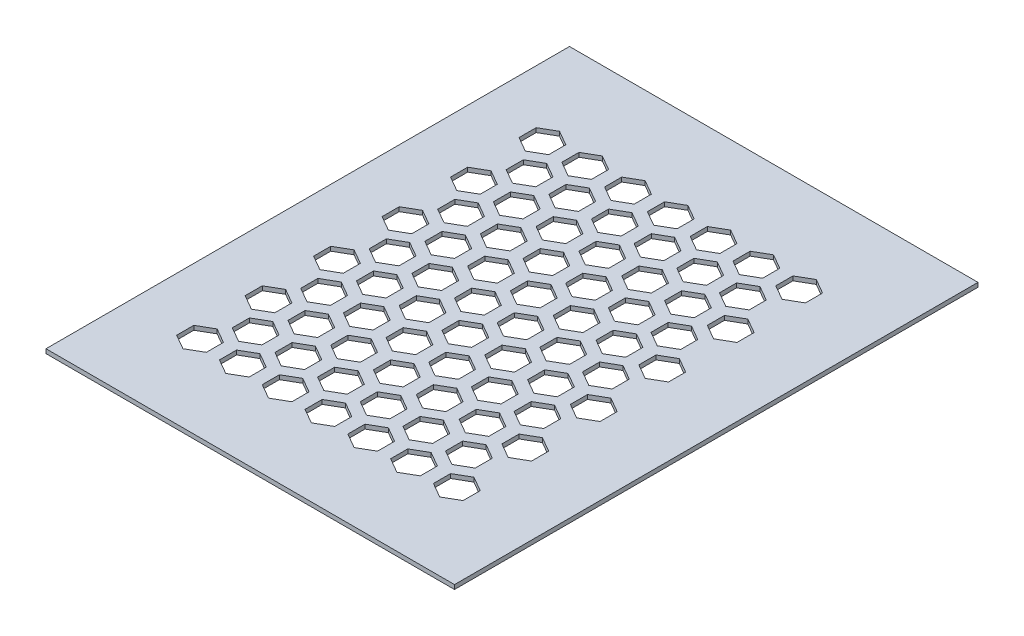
SolidWorks part; units mm, degrees
ref_plane "Front Plane" through (0, 0, 0) normal (0, 0, 1) x (1, 0, 0)
ref_plane "Top Plane" through (0, 0, 0) normal (0, 1, 0) x (1, 0, 0)
ref_plane "Right Plane" through (0, 0, 0) normal (1, 0, 0) x (0, 0, -1)
sketch "Sketch1" plane through (0, 402.2121, 0) normal (0, 1, 0) x (1, 0, 0)
  line L0 (-610.7154, -702.6158) -> (-607.5404, -702.6158) construction
  line L1 (-609.1279, -702.6158) -> (-912.2029, -702.6158)
  line L2 (-609.1279, -702.6158) -> (-609.1279, -1090.9892)
  line L3 (-609.1279, -1090.9892) -> (-912.2029, -1090.9892)
  line L4 (-912.2029, -702.6158) -> (-912.2029, -1090.9892)
extrude "Boss-Extrude1" add sketch "Sketch1" along normal blind 3.175
sketch "Sketch2" plane through (0, 405.3871, 0) normal (0, 1, 0) x (1, 0, 0)
  line L0 (-912.2029, -1090.9892) -> (-609.1279, -1090.9892) construction
  line L1 (-861.4156, -1014.7892) -> (-872.4141, -1021.1392)
  line L2 (-872.4141, -1021.1392) -> (-872.4141, -1033.8392)
  line L3 (-872.4141, -1033.8392) -> (-861.4156, -1040.1892)
  line L4 (-861.4156, -1040.1892) -> (-850.417, -1033.8392)
  line L5 (-850.417, -1033.8392) -> (-850.417, -1021.1392)
  line L6 (-850.417, -1021.1392) -> (-861.4156, -1014.7892)
  line L7 (-912.2029, -702.6158) -> (-912.2029, -1090.9892) construction
  line L8 (-829.6656, -1014.7892) -> (-840.6641, -1021.1392)
  line L9 (-840.6641, -1021.1392) -> (-840.6641, -1033.8392)
  line L10 (-840.6641, -1033.8392) -> (-829.6656, -1040.1892)
  line L11 (-829.6656, -1040.1892) -> (-818.667, -1033.8392)
  line L12 (-818.667, -1033.8392) -> (-818.667, -1021.1392)
  line L13 (-818.667, -1021.1392) -> (-829.6656, -1014.7892)
  line L14 (-797.9156, -1014.7892) -> (-808.9141, -1021.1392)
  line L15 (-808.9141, -1021.1392) -> (-808.9141, -1033.8392)
  line L16 (-808.9141, -1033.8392) -> (-797.9156, -1040.1892)
  line L17 (-797.9156, -1040.1892) -> (-786.917, -1033.8392)
  line L18 (-786.917, -1033.8392) -> (-786.917, -1021.1392)
  line L19 (-786.917, -1021.1392) -> (-797.9156, -1014.7892)
  line L20 (-766.1656, -1014.7892) -> (-777.1641, -1021.1392)
  line L21 (-777.1641, -1021.1392) -> (-777.1641, -1033.8392)
  line L22 (-777.1641, -1033.8392) -> (-766.1656, -1040.1892)
  line L23 (-766.1656, -1040.1892) -> (-755.167, -1033.8392)
  line L24 (-755.167, -1033.8392) -> (-755.167, -1021.1392)
  line L25 (-755.167, -1021.1392) -> (-766.1656, -1014.7892)
  line L26 (-734.4156, -1014.7892) -> (-745.4141, -1021.1392)
  line L27 (-745.4141, -1021.1392) -> (-745.4141, -1033.8392)
  line L28 (-745.4141, -1033.8392) -> (-734.4156, -1040.1892)
  line L29 (-734.4156, -1040.1892) -> (-723.417, -1033.8392)
  line L30 (-723.417, -1033.8392) -> (-723.417, -1021.1392)
  line L31 (-723.417, -1021.1392) -> (-734.4156, -1014.7892)
  line L32 (-702.6656, -1014.7892) -> (-713.6641, -1021.1392)
  line L33 (-713.6641, -1021.1392) -> (-713.6641, -1033.8392)
  line L34 (-713.6641, -1033.8392) -> (-702.6656, -1040.1892)
  line L35 (-702.6656, -1040.1892) -> (-691.667, -1033.8392)
  line L36 (-691.667, -1033.8392) -> (-691.667, -1021.1392)
  line L37 (-691.667, -1021.1392) -> (-702.6656, -1014.7892)
  line L38 (-670.9156, -1014.7892) -> (-681.9141, -1021.1392)
  line L39 (-681.9141, -1021.1392) -> (-681.9141, -1033.8392)
  line L40 (-681.9141, -1033.8392) -> (-670.9156, -1040.1892)
  line L41 (-670.9156, -1040.1892) -> (-659.917, -1033.8392)
  line L42 (-659.917, -1033.8392) -> (-659.917, -1021.1392)
  line L43 (-659.917, -1021.1392) -> (-670.9156, -1014.7892)
  line L44 (-850.417, -1021.1392) -> (-840.6641, -1021.1392) construction
  line L45 (-834.542, -1008.4392) -> (-834.542, -995.7392)
  line L46 (-834.542, -995.7392) -> (-845.5406, -989.3892)
  line L47 (-845.5406, -989.3892) -> (-856.5391, -995.7392)
  line L48 (-856.5391, -995.7392) -> (-856.5391, -1008.4392)
  line L49 (-856.5391, -1008.4392) -> (-845.5406, -1014.7892)
  line L50 (-845.5406, -1014.7892) -> (-834.542, -1008.4392)
  line L51 (-802.8936, -1008.4392) -> (-802.8936, -995.7392)
  line L52 (-802.8936, -995.7392) -> (-813.8922, -989.3892)
  line L53 (-813.8922, -989.3892) -> (-824.8907, -995.7392)
  line L54 (-824.8907, -995.7392) -> (-824.8907, -1008.4392)
  line L55 (-824.8907, -1008.4392) -> (-813.8922, -1014.7892)
  line L56 (-813.8922, -1014.7892) -> (-802.8936, -1008.4392)
  line L57 (-771.2452, -1008.4392) -> (-771.2452, -995.7392)
  line L58 (-771.2452, -995.7392) -> (-782.2438, -989.3892)
  line L59 (-782.2438, -989.3892) -> (-793.2423, -995.7392)
  line L60 (-793.2423, -995.7392) -> (-793.2423, -1008.4392)
  line L61 (-793.2423, -1008.4392) -> (-782.2438, -1014.7892)
  line L62 (-782.2438, -1014.7892) -> (-771.2452, -1008.4392)
  line L63 (-739.5968, -1008.4392) -> (-739.5968, -995.7392)
  line L64 (-739.5968, -995.7392) -> (-750.5954, -989.3892)
  line L65 (-750.5954, -989.3892) -> (-761.5939, -995.7392)
  line L66 (-761.5939, -995.7392) -> (-761.5939, -1008.4392)
  line L67 (-761.5939, -1008.4392) -> (-750.5954, -1014.7892)
  line L68 (-750.5954, -1014.7892) -> (-739.5968, -1008.4392)
  line L69 (-707.9484, -1008.4392) -> (-707.9484, -995.7392)
  line L70 (-707.9484, -995.7392) -> (-718.947, -989.3892)
  line L71 (-718.947, -989.3892) -> (-729.9455, -995.7392)
  line L72 (-729.9455, -995.7392) -> (-729.9455, -1008.4392)
  line L73 (-729.9455, -1008.4392) -> (-718.947, -1014.7892)
  line L74 (-718.947, -1014.7892) -> (-707.9484, -1008.4392)
  line L75 (-676.3, -1008.4392) -> (-676.3, -995.7392)
  line L76 (-676.3, -995.7392) -> (-687.2986, -989.3892)
  line L77 (-687.2986, -989.3892) -> (-698.2971, -995.7392)
  line L78 (-698.2971, -995.7392) -> (-698.2971, -1008.4392)
  line L79 (-698.2971, -1008.4392) -> (-687.2986, -1014.7892)
  line L80 (-687.2986, -1014.7892) -> (-676.3, -1008.4392)
  line L81 (-670.9156, -963.9892) -> (-681.9141, -970.3392)
  line L82 (-681.9141, -970.3392) -> (-681.9141, -983.0392)
  line L83 (-681.9141, -983.0392) -> (-670.9156, -989.3892)
  line L84 (-670.9156, -989.3892) -> (-659.917, -983.0392)
  line L85 (-659.917, -983.0392) -> (-659.917, -970.3392)
  line L86 (-659.917, -970.3392) -> (-670.9156, -963.9892)
  line L87 (-702.6656, -963.9892) -> (-713.6641, -970.3392)
  line L88 (-713.6641, -970.3392) -> (-713.6641, -983.0392)
  line L89 (-713.6641, -983.0392) -> (-702.6656, -989.3892)
  line L90 (-702.6656, -989.3892) -> (-691.667, -983.0392)
  line L91 (-691.667, -983.0392) -> (-691.667, -970.3392)
  line L92 (-691.667, -970.3392) -> (-702.6656, -963.9892)
  line L93 (-734.4156, -963.9892) -> (-745.4141, -970.3392)
  line L94 (-745.4141, -970.3392) -> (-745.4141, -983.0392)
  line L95 (-745.4141, -983.0392) -> (-734.4156, -989.3892)
  line L96 (-734.4156, -989.3892) -> (-723.417, -983.0392)
  line L97 (-723.417, -983.0392) -> (-723.417, -970.3392)
  line L98 (-723.417, -970.3392) -> (-734.4156, -963.9892)
  line L99 (-766.1656, -963.9892) -> (-777.1641, -970.3392)
  line L100 (-777.1641, -970.3392) -> (-777.1641, -983.0392)
  line L101 (-777.1641, -983.0392) -> (-766.1656, -989.3892)
  line L102 (-766.1656, -989.3892) -> (-755.167, -983.0392)
  line L103 (-755.167, -983.0392) -> (-755.167, -970.3392)
  line L104 (-755.167, -970.3392) -> (-766.1656, -963.9892)
  line L105 (-797.9156, -963.9892) -> (-808.9141, -970.3392)
  line L106 (-808.9141, -970.3392) -> (-808.9141, -983.0392)
  line L107 (-808.9141, -983.0392) -> (-797.9156, -989.3892)
  line L108 (-797.9156, -989.3892) -> (-786.917, -983.0392)
  line L109 (-786.917, -983.0392) -> (-786.917, -970.3392)
  line L110 (-786.917, -970.3392) -> (-797.9156, -963.9892)
  line L111 (-829.6656, -963.9892) -> (-840.6641, -970.3392)
  line L112 (-840.6641, -970.3392) -> (-840.6641, -983.0392)
  line L113 (-840.6641, -983.0392) -> (-829.6656, -989.3892)
  line L114 (-829.6656, -989.3892) -> (-818.667, -983.0392)
  line L115 (-818.667, -983.0392) -> (-818.667, -970.3392)
  line L116 (-818.667, -970.3392) -> (-829.6656, -963.9892)
  line L117 (-861.4156, -963.9892) -> (-872.4141, -970.3392)
  line L118 (-872.4141, -970.3392) -> (-872.4141, -983.0392)
  line L119 (-872.4141, -983.0392) -> (-861.4156, -989.3892)
  line L120 (-861.4156, -989.3892) -> (-850.417, -983.0392)
  line L121 (-850.417, -983.0392) -> (-850.417, -970.3392)
  line L122 (-850.417, -970.3392) -> (-861.4156, -963.9892)
  line L123 (-834.542, -957.6392) -> (-834.542, -944.9392)
  line L124 (-834.542, -944.9392) -> (-845.5406, -938.5892)
  line L125 (-845.5406, -938.5892) -> (-856.5391, -944.9392)
  line L126 (-856.5391, -944.9392) -> (-856.5391, -957.6392)
  line L127 (-856.5391, -957.6392) -> (-845.5406, -963.9892)
  line L128 (-845.5406, -963.9892) -> (-834.542, -957.6392)
  line L129 (-802.8936, -957.6392) -> (-802.8936, -944.9392)
  line L130 (-802.8936, -944.9392) -> (-813.8922, -938.5892)
  line L131 (-813.8922, -938.5892) -> (-824.8907, -944.9392)
  line L132 (-824.8907, -944.9392) -> (-824.8907, -957.6392)
  line L133 (-824.8907, -957.6392) -> (-813.8922, -963.9892)
  line L134 (-813.8922, -963.9892) -> (-802.8936, -957.6392)
  line L135 (-771.2452, -957.6392) -> (-771.2452, -944.9392)
  line L136 (-771.2452, -944.9392) -> (-782.2438, -938.5892)
  line L137 (-782.2438, -938.5892) -> (-793.2423, -944.9392)
  line L138 (-793.2423, -944.9392) -> (-793.2423, -957.6392)
  line L139 (-793.2423, -957.6392) -> (-782.2438, -963.9892)
  line L140 (-782.2438, -963.9892) -> (-771.2452, -957.6392)
  line L141 (-739.5968, -957.6392) -> (-739.5968, -944.9392)
  line L142 (-739.5968, -944.9392) -> (-750.5954, -938.5892)
  line L143 (-750.5954, -938.5892) -> (-761.5939, -944.9392)
  line L144 (-761.5939, -944.9392) -> (-761.5939, -957.6392)
  line L145 (-761.5939, -957.6392) -> (-750.5954, -963.9892)
  line L146 (-750.5954, -963.9892) -> (-739.5968, -957.6392)
  line L147 (-707.9484, -957.6392) -> (-707.9484, -944.9392)
  line L148 (-707.9484, -944.9392) -> (-718.947, -938.5892)
  line L149 (-718.947, -938.5892) -> (-729.9455, -944.9392)
  line L150 (-729.9455, -944.9392) -> (-729.9455, -957.6392)
  line L151 (-729.9455, -957.6392) -> (-718.947, -963.9892)
  line L152 (-718.947, -963.9892) -> (-707.9484, -957.6392)
  line L153 (-676.3, -957.6392) -> (-676.3, -944.9392)
  line L154 (-676.3, -944.9392) -> (-687.2986, -938.5892)
  line L155 (-687.2986, -938.5892) -> (-698.2971, -944.9392)
  line L156 (-698.2971, -944.9392) -> (-698.2971, -957.6392)
  line L157 (-698.2971, -957.6392) -> (-687.2986, -963.9892)
  line L158 (-687.2986, -963.9892) -> (-676.3, -957.6392)
  line L159 (-670.9156, -913.1892) -> (-681.9141, -919.5392)
  line L160 (-681.9141, -919.5392) -> (-681.9141, -932.2392)
  line L161 (-681.9141, -932.2392) -> (-670.9156, -938.5892)
  line L162 (-670.9156, -938.5892) -> (-659.917, -932.2392)
  line L163 (-659.917, -932.2392) -> (-659.917, -919.5392)
  line L164 (-659.917, -919.5392) -> (-670.9156, -913.1892)
  line L165 (-702.6656, -913.1892) -> (-713.6641, -919.5392)
  line L166 (-713.6641, -919.5392) -> (-713.6641, -932.2392)
  line L167 (-713.6641, -932.2392) -> (-702.6656, -938.5892)
  line L168 (-702.6656, -938.5892) -> (-691.667, -932.2392)
  line L169 (-691.667, -932.2392) -> (-691.667, -919.5392)
  line L170 (-691.667, -919.5392) -> (-702.6656, -913.1892)
  line L171 (-734.4156, -913.1892) -> (-745.4141, -919.5392)
  line L172 (-745.4141, -919.5392) -> (-745.4141, -932.2392)
  line L173 (-745.4141, -932.2392) -> (-734.4156, -938.5892)
  line L174 (-734.4156, -938.5892) -> (-723.417, -932.2392)
  line L175 (-723.417, -932.2392) -> (-723.417, -919.5392)
  line L176 (-723.417, -919.5392) -> (-734.4156, -913.1892)
  line L177 (-766.1656, -913.1892) -> (-777.1641, -919.5392)
  line L178 (-777.1641, -919.5392) -> (-777.1641, -932.2392)
  line L179 (-777.1641, -932.2392) -> (-766.1656, -938.5892)
  line L180 (-766.1656, -938.5892) -> (-755.167, -932.2392)
  line L181 (-755.167, -932.2392) -> (-755.167, -919.5392)
  line L182 (-755.167, -919.5392) -> (-766.1656, -913.1892)
  line L183 (-797.9156, -913.1892) -> (-808.9141, -919.5392)
  line L184 (-808.9141, -919.5392) -> (-808.9141, -932.2392)
  line L185 (-808.9141, -932.2392) -> (-797.9156, -938.5892)
  line L186 (-797.9156, -938.5892) -> (-786.917, -932.2392)
  line L187 (-786.917, -932.2392) -> (-786.917, -919.5392)
  line L188 (-786.917, -919.5392) -> (-797.9156, -913.1892)
  line L189 (-829.6656, -913.1892) -> (-840.6641, -919.5392)
  line L190 (-840.6641, -919.5392) -> (-840.6641, -932.2392)
  line L191 (-840.6641, -932.2392) -> (-829.6656, -938.5892)
  line L192 (-829.6656, -938.5892) -> (-818.667, -932.2392)
  line L193 (-818.667, -932.2392) -> (-818.667, -919.5392)
  line L194 (-818.667, -919.5392) -> (-829.6656, -913.1892)
  line L195 (-861.4156, -913.1892) -> (-872.4141, -919.5392)
  line L196 (-872.4141, -919.5392) -> (-872.4141, -932.2392)
  line L197 (-872.4141, -932.2392) -> (-861.4156, -938.5892)
  line L198 (-861.4156, -938.5892) -> (-850.417, -932.2392)
  line L199 (-850.417, -932.2392) -> (-850.417, -919.5392)
  line L200 (-850.417, -919.5392) -> (-861.4156, -913.1892)
  line L201 (-834.542, -906.8392) -> (-834.542, -894.1392)
  line L202 (-834.542, -894.1392) -> (-845.5406, -887.7892)
  line L203 (-845.5406, -887.7892) -> (-856.5391, -894.1392)
  line L204 (-856.5391, -894.1392) -> (-856.5391, -906.8392)
  line L205 (-856.5391, -906.8392) -> (-845.5406, -913.1892)
  line L206 (-845.5406, -913.1892) -> (-834.542, -906.8392)
  line L207 (-802.8936, -906.8392) -> (-802.8936, -894.1392)
  line L208 (-802.8936, -894.1392) -> (-813.8922, -887.7892)
  line L209 (-813.8922, -887.7892) -> (-824.8907, -894.1392)
  line L210 (-824.8907, -894.1392) -> (-824.8907, -906.8392)
  line L211 (-824.8907, -906.8392) -> (-813.8922, -913.1892)
  line L212 (-813.8922, -913.1892) -> (-802.8936, -906.8392)
  line L213 (-771.2452, -906.8392) -> (-771.2452, -894.1392)
  line L214 (-771.2452, -894.1392) -> (-782.2438, -887.7892)
  line L215 (-782.2438, -887.7892) -> (-793.2423, -894.1392)
  line L216 (-793.2423, -894.1392) -> (-793.2423, -906.8392)
  line L217 (-793.2423, -906.8392) -> (-782.2438, -913.1892)
  line L218 (-782.2438, -913.1892) -> (-771.2452, -906.8392)
  line L219 (-739.5968, -906.8392) -> (-739.5968, -894.1392)
  line L220 (-739.5968, -894.1392) -> (-750.5954, -887.7892)
  line L221 (-750.5954, -887.7892) -> (-761.5939, -894.1392)
  line L222 (-761.5939, -894.1392) -> (-761.5939, -906.8392)
  line L223 (-761.5939, -906.8392) -> (-750.5954, -913.1892)
  line L224 (-750.5954, -913.1892) -> (-739.5968, -906.8392)
  line L225 (-707.9484, -906.8392) -> (-707.9484, -894.1392)
  line L226 (-707.9484, -894.1392) -> (-718.947, -887.7892)
  line L227 (-718.947, -887.7892) -> (-729.9455, -894.1392)
  line L228 (-729.9455, -894.1392) -> (-729.9455, -906.8392)
  line L229 (-729.9455, -906.8392) -> (-718.947, -913.1892)
  line L230 (-718.947, -913.1892) -> (-707.9484, -906.8392)
  line L231 (-676.3, -906.8392) -> (-676.3, -894.1392)
  line L232 (-676.3, -894.1392) -> (-687.2986, -887.7892)
  line L233 (-687.2986, -887.7892) -> (-698.2971, -894.1392)
  line L234 (-698.2971, -894.1392) -> (-698.2971, -906.8392)
  line L235 (-698.2971, -906.8392) -> (-687.2986, -913.1892)
  line L236 (-687.2986, -913.1892) -> (-676.3, -906.8392)
  line L237 (-670.9156, -862.3892) -> (-681.9141, -868.7392)
  line L238 (-681.9141, -868.7392) -> (-681.9141, -881.4392)
  line L239 (-681.9141, -881.4392) -> (-670.9156, -887.7892)
  line L240 (-670.9156, -887.7892) -> (-659.917, -881.4392)
  line L241 (-659.917, -881.4392) -> (-659.917, -868.7392)
  line L242 (-659.917, -868.7392) -> (-670.9156, -862.3892)
  line L243 (-702.6656, -862.3892) -> (-713.6641, -868.7392)
  line L244 (-713.6641, -868.7392) -> (-713.6641, -881.4392)
  line L245 (-713.6641, -881.4392) -> (-702.6656, -887.7892)
  line L246 (-702.6656, -887.7892) -> (-691.667, -881.4392)
  line L247 (-691.667, -881.4392) -> (-691.667, -868.7392)
  line L248 (-691.667, -868.7392) -> (-702.6656, -862.3892)
  line L249 (-734.4156, -862.3892) -> (-745.4141, -868.7392)
  line L250 (-745.4141, -868.7392) -> (-745.4141, -881.4392)
  line L251 (-745.4141, -881.4392) -> (-734.4156, -887.7892)
  line L252 (-734.4156, -887.7892) -> (-723.417, -881.4392)
  line L253 (-723.417, -881.4392) -> (-723.417, -868.7392)
  line L254 (-723.417, -868.7392) -> (-734.4156, -862.3892)
  line L255 (-766.1656, -862.3892) -> (-777.1641, -868.7392)
  line L256 (-777.1641, -868.7392) -> (-777.1641, -881.4392)
  line L257 (-777.1641, -881.4392) -> (-766.1656, -887.7892)
  line L258 (-766.1656, -887.7892) -> (-755.167, -881.4392)
  line L259 (-755.167, -881.4392) -> (-755.167, -868.7392)
  line L260 (-755.167, -868.7392) -> (-766.1656, -862.3892)
  line L261 (-797.9156, -862.3892) -> (-808.9141, -868.7392)
  line L262 (-808.9141, -868.7392) -> (-808.9141, -881.4392)
  line L263 (-808.9141, -881.4392) -> (-797.9156, -887.7892)
  line L264 (-797.9156, -887.7892) -> (-786.917, -881.4392)
  line L265 (-786.917, -881.4392) -> (-786.917, -868.7392)
  line L266 (-786.917, -868.7392) -> (-797.9156, -862.3892)
  line L267 (-829.6656, -862.3892) -> (-840.6641, -868.7392)
  line L268 (-840.6641, -868.7392) -> (-840.6641, -881.4392)
  line L269 (-840.6641, -881.4392) -> (-829.6656, -887.7892)
  line L270 (-829.6656, -887.7892) -> (-818.667, -881.4392)
  line L271 (-818.667, -881.4392) -> (-818.667, -868.7392)
  line L272 (-818.667, -868.7392) -> (-829.6656, -862.3892)
  line L273 (-861.4156, -862.3892) -> (-872.4141, -868.7392)
  line L274 (-872.4141, -868.7392) -> (-872.4141, -881.4392)
  line L275 (-872.4141, -881.4392) -> (-861.4156, -887.7892)
  line L276 (-861.4156, -887.7892) -> (-850.417, -881.4392)
  line L277 (-850.417, -881.4392) -> (-850.417, -868.7392)
  line L278 (-850.417, -868.7392) -> (-861.4156, -862.3892)
  line L279 (-834.542, -856.0392) -> (-834.542, -843.3392)
  line L280 (-834.542, -843.3392) -> (-845.5406, -836.9892)
  line L281 (-845.5406, -836.9892) -> (-856.5391, -843.3392)
  line L282 (-856.5391, -843.3392) -> (-856.5391, -856.0392)
  line L283 (-856.5391, -856.0392) -> (-845.5406, -862.3892)
  line L284 (-845.5406, -862.3892) -> (-834.542, -856.0392)
  line L285 (-802.8936, -856.0392) -> (-802.8936, -843.3392)
  line L286 (-802.8936, -843.3392) -> (-813.8922, -836.9892)
  line L287 (-813.8922, -836.9892) -> (-824.8907, -843.3392)
  line L288 (-824.8907, -843.3392) -> (-824.8907, -856.0392)
  line L289 (-824.8907, -856.0392) -> (-813.8922, -862.3892)
  line L290 (-813.8922, -862.3892) -> (-802.8936, -856.0392)
  line L291 (-771.2452, -856.0392) -> (-771.2452, -843.3392)
  line L292 (-771.2452, -843.3392) -> (-782.2438, -836.9892)
  line L293 (-782.2438, -836.9892) -> (-793.2423, -843.3392)
  line L294 (-793.2423, -843.3392) -> (-793.2423, -856.0392)
  line L295 (-793.2423, -856.0392) -> (-782.2438, -862.3892)
  line L296 (-782.2438, -862.3892) -> (-771.2452, -856.0392)
  line L297 (-739.5968, -856.0392) -> (-739.5968, -843.3392)
  line L298 (-739.5968, -843.3392) -> (-750.5954, -836.9892)
  line L299 (-750.5954, -836.9892) -> (-761.5939, -843.3392)
  line L300 (-761.5939, -843.3392) -> (-761.5939, -856.0392)
  line L301 (-761.5939, -856.0392) -> (-750.5954, -862.3892)
  line L302 (-750.5954, -862.3892) -> (-739.5968, -856.0392)
  line L303 (-707.9484, -856.0392) -> (-707.9484, -843.3392)
  line L304 (-707.9484, -843.3392) -> (-718.947, -836.9892)
  line L305 (-718.947, -836.9892) -> (-729.9455, -843.3392)
  line L306 (-729.9455, -843.3392) -> (-729.9455, -856.0392)
  line L307 (-729.9455, -856.0392) -> (-718.947, -862.3892)
  line L308 (-718.947, -862.3892) -> (-707.9484, -856.0392)
  line L309 (-676.3, -856.0392) -> (-676.3, -843.3392)
  line L310 (-676.3, -843.3392) -> (-687.2986, -836.9892)
  line L311 (-687.2986, -836.9892) -> (-698.2971, -843.3392)
  line L312 (-698.2971, -843.3392) -> (-698.2971, -856.0392)
  line L313 (-698.2971, -856.0392) -> (-687.2986, -862.3892)
  line L314 (-687.2986, -862.3892) -> (-676.3, -856.0392)
  line L315 (-670.9156, -811.5892) -> (-681.9141, -817.9392)
  line L316 (-681.9141, -817.9392) -> (-681.9141, -830.6392)
  line L317 (-681.9141, -830.6392) -> (-670.9156, -836.9892)
  line L318 (-670.9156, -836.9892) -> (-659.917, -830.6392)
  line L319 (-659.917, -830.6392) -> (-659.917, -817.9392)
  line L320 (-659.917, -817.9392) -> (-670.9156, -811.5892)
  line L321 (-702.6656, -811.5892) -> (-713.6641, -817.9392)
  line L322 (-713.6641, -817.9392) -> (-713.6641, -830.6392)
  line L323 (-713.6641, -830.6392) -> (-702.6656, -836.9892)
  line L324 (-702.6656, -836.9892) -> (-691.667, -830.6392)
  line L325 (-691.667, -830.6392) -> (-691.667, -817.9392)
  line L326 (-691.667, -817.9392) -> (-702.6656, -811.5892)
  line L327 (-734.4156, -811.5892) -> (-745.4141, -817.9392)
  line L328 (-745.4141, -817.9392) -> (-745.4141, -830.6392)
  line L329 (-745.4141, -830.6392) -> (-734.4156, -836.9892)
  line L330 (-734.4156, -836.9892) -> (-723.417, -830.6392)
  line L331 (-723.417, -830.6392) -> (-723.417, -817.9392)
  line L332 (-723.417, -817.9392) -> (-734.4156, -811.5892)
  line L333 (-766.1656, -811.5892) -> (-777.1641, -817.9392)
  line L334 (-777.1641, -817.9392) -> (-777.1641, -830.6392)
  line L335 (-777.1641, -830.6392) -> (-766.1656, -836.9892)
  line L336 (-766.1656, -836.9892) -> (-755.167, -830.6392)
  line L337 (-755.167, -830.6392) -> (-755.167, -817.9392)
  line L338 (-755.167, -817.9392) -> (-766.1656, -811.5892)
  line L339 (-797.9156, -811.5892) -> (-808.9141, -817.9392)
  line L340 (-808.9141, -817.9392) -> (-808.9141, -830.6392)
  line L341 (-808.9141, -830.6392) -> (-797.9156, -836.9892)
  line L342 (-797.9156, -836.9892) -> (-786.917, -830.6392)
  line L343 (-786.917, -830.6392) -> (-786.917, -817.9392)
  line L344 (-786.917, -817.9392) -> (-797.9156, -811.5892)
  line L345 (-829.6656, -811.5892) -> (-840.6641, -817.9392)
  line L346 (-840.6641, -817.9392) -> (-840.6641, -830.6392)
  line L347 (-840.6641, -830.6392) -> (-829.6656, -836.9892)
  line L348 (-829.6656, -836.9892) -> (-818.667, -830.6392)
  line L349 (-818.667, -830.6392) -> (-818.667, -817.9392)
  line L350 (-818.667, -817.9392) -> (-829.6656, -811.5892)
  line L351 (-861.4156, -811.5892) -> (-872.4141, -817.9392)
  line L352 (-872.4141, -817.9392) -> (-872.4141, -830.6392)
  line L353 (-872.4141, -830.6392) -> (-861.4156, -836.9892)
  line L354 (-861.4156, -836.9892) -> (-850.417, -830.6392)
  line L355 (-850.417, -830.6392) -> (-850.417, -817.9392)
  line L356 (-850.417, -817.9392) -> (-861.4156, -811.5892)
  line L357 (-834.542, -805.2392) -> (-834.542, -792.5392)
  line L358 (-834.542, -792.5392) -> (-845.5406, -786.1892)
  line L359 (-845.5406, -786.1892) -> (-856.5391, -792.5392)
  line L360 (-856.5391, -792.5392) -> (-856.5391, -805.2392)
  line L361 (-856.5391, -805.2392) -> (-845.5406, -811.5892)
  line L362 (-845.5406, -811.5892) -> (-834.542, -805.2392)
  line L363 (-802.8936, -805.2392) -> (-802.8936, -792.5392)
  line L364 (-802.8936, -792.5392) -> (-813.8922, -786.1892)
  line L365 (-813.8922, -786.1892) -> (-824.8907, -792.5392)
  line L366 (-824.8907, -792.5392) -> (-824.8907, -805.2392)
  line L367 (-824.8907, -805.2392) -> (-813.8922, -811.5892)
  line L368 (-813.8922, -811.5892) -> (-802.8936, -805.2392)
  line L369 (-771.2452, -805.2392) -> (-771.2452, -792.5392)
  line L370 (-771.2452, -792.5392) -> (-782.2438, -786.1892)
  line L371 (-782.2438, -786.1892) -> (-793.2423, -792.5392)
  line L372 (-793.2423, -792.5392) -> (-793.2423, -805.2392)
  line L373 (-793.2423, -805.2392) -> (-782.2438, -811.5892)
  line L374 (-782.2438, -811.5892) -> (-771.2452, -805.2392)
  line L375 (-739.5968, -805.2392) -> (-739.5968, -792.5392)
  line L376 (-739.5968, -792.5392) -> (-750.5954, -786.1892)
  line L377 (-750.5954, -786.1892) -> (-761.5939, -792.5392)
  line L378 (-761.5939, -792.5392) -> (-761.5939, -805.2392)
  line L379 (-761.5939, -805.2392) -> (-750.5954, -811.5892)
  line L380 (-750.5954, -811.5892) -> (-739.5968, -805.2392)
  line L381 (-707.9484, -805.2392) -> (-707.9484, -792.5392)
  line L382 (-707.9484, -792.5392) -> (-718.947, -786.1892)
  line L383 (-718.947, -786.1892) -> (-729.9455, -792.5392)
  line L384 (-729.9455, -792.5392) -> (-729.9455, -805.2392)
  line L385 (-729.9455, -805.2392) -> (-718.947, -811.5892)
  line L386 (-718.947, -811.5892) -> (-707.9484, -805.2392)
  line L387 (-676.3, -805.2392) -> (-676.3, -792.5392)
  line L388 (-676.3, -792.5392) -> (-687.2986, -786.1892)
  line L389 (-687.2986, -786.1892) -> (-698.2971, -792.5392)
  line L390 (-698.2971, -792.5392) -> (-698.2971, -805.2392)
  line L391 (-698.2971, -805.2392) -> (-687.2986, -811.5892)
  line L392 (-687.2986, -811.5892) -> (-676.3, -805.2392)
  line L394 (-872.4141, -767.1392) -> (-872.4141, -779.8392)
  line L395 (-872.4141, -779.8392) -> (-861.4156, -786.1892)
  line L396 (-861.4156, -786.1892) -> (-850.417, -779.8392)
  line L397 (-850.417, -779.8392) -> (-850.417, -767.1392)
  line L398 (-850.417, -767.1392) -> (-861.4156, -760.7892)
  line L399 (-861.4156, -760.7892) -> (-872.4141, -767.1392)
  line L400 (-840.6641, -767.1392) -> (-840.6641, -779.8392)
  line L401 (-840.6641, -779.8392) -> (-829.6656, -786.1892)
  line L402 (-829.6656, -786.1892) -> (-818.667, -779.8392)
  line L403 (-818.667, -779.8392) -> (-818.667, -767.1392)
  line L404 (-818.667, -767.1392) -> (-829.6656, -760.7892)
  line L405 (-829.6656, -760.7892) -> (-840.6641, -767.1392)
  line L406 (-808.9141, -767.1392) -> (-808.9141, -779.8392)
  line L407 (-808.9141, -779.8392) -> (-797.9156, -786.1892)
  line L408 (-797.9156, -786.1892) -> (-786.917, -779.8392)
  line L409 (-786.917, -779.8392) -> (-786.917, -767.1392)
  line L410 (-786.917, -767.1392) -> (-797.9156, -760.7892)
  line L411 (-797.9156, -760.7892) -> (-808.9141, -767.1392)
  line L412 (-777.1641, -767.1392) -> (-777.1641, -779.8392)
  line L413 (-777.1641, -779.8392) -> (-766.1656, -786.1892)
  line L414 (-766.1656, -786.1892) -> (-755.167, -779.8392)
  line L415 (-755.167, -779.8392) -> (-755.167, -767.1392)
  line L416 (-755.167, -767.1392) -> (-766.1656, -760.7892)
  line L417 (-766.1656, -760.7892) -> (-777.1641, -767.1392)
  line L418 (-745.4141, -767.1392) -> (-745.4141, -779.8392)
  line L419 (-745.4141, -779.8392) -> (-734.4156, -786.1892)
  line L420 (-734.4156, -786.1892) -> (-723.417, -779.8392)
  line L421 (-723.417, -779.8392) -> (-723.417, -767.1392)
  line L422 (-723.417, -767.1392) -> (-734.4156, -760.7892)
  line L423 (-734.4156, -760.7892) -> (-745.4141, -767.1392)
  line L424 (-713.6641, -767.1392) -> (-713.6641, -779.8392)
  line L425 (-713.6641, -779.8392) -> (-702.6656, -786.1892)
  line L426 (-702.6656, -786.1892) -> (-691.667, -779.8392)
  line L427 (-691.667, -779.8392) -> (-691.667, -767.1392)
  line L428 (-691.667, -767.1392) -> (-702.6656, -760.7892)
  line L429 (-702.6656, -760.7892) -> (-713.6641, -767.1392)
  line L430 (-681.9141, -767.1392) -> (-681.9141, -779.8392)
  line L431 (-681.9141, -779.8392) -> (-670.9156, -786.1892)
  line L432 (-670.9156, -786.1892) -> (-659.917, -779.8392)
  line L433 (-659.917, -779.8392) -> (-659.917, -767.1392)
  line L434 (-659.917, -767.1392) -> (-670.9156, -760.7892)
  line L435 (-670.9156, -760.7892) -> (-681.9141, -767.1392)
  circle A0 centre (-861.4156, -1027.4892) radius 10.9985 construction
  circle A1 centre (-845.5406, -1002.0892) radius 10.9985 construction
  circle A2 centre (-861.4156, -773.4892) radius 10.9985 construction
  point P18 (-845.5406, -1021.1392)
  point P400 (0, 0)
  dimension "D1" = 63.5
  dimension "D2" = 12.7
  dimension "D3" = 50.7873
  dimension "D4" = 7
  dimension "D5" = 9.753
  dimension "D6" = 12.7
  dimension "D7" = 6.35
  dimension "D9" = 9.6514
  dimension "D11" = 6.35
  dimension "D12" = 12.7
  dimension "D13" = 6.35
  dimension "D8" = 6
  dimension "D10" = 5
  dimension "D14" = 7
extrude "Cut-Extrude1" cut sketch "Sketch2" against normal blind 3.175
